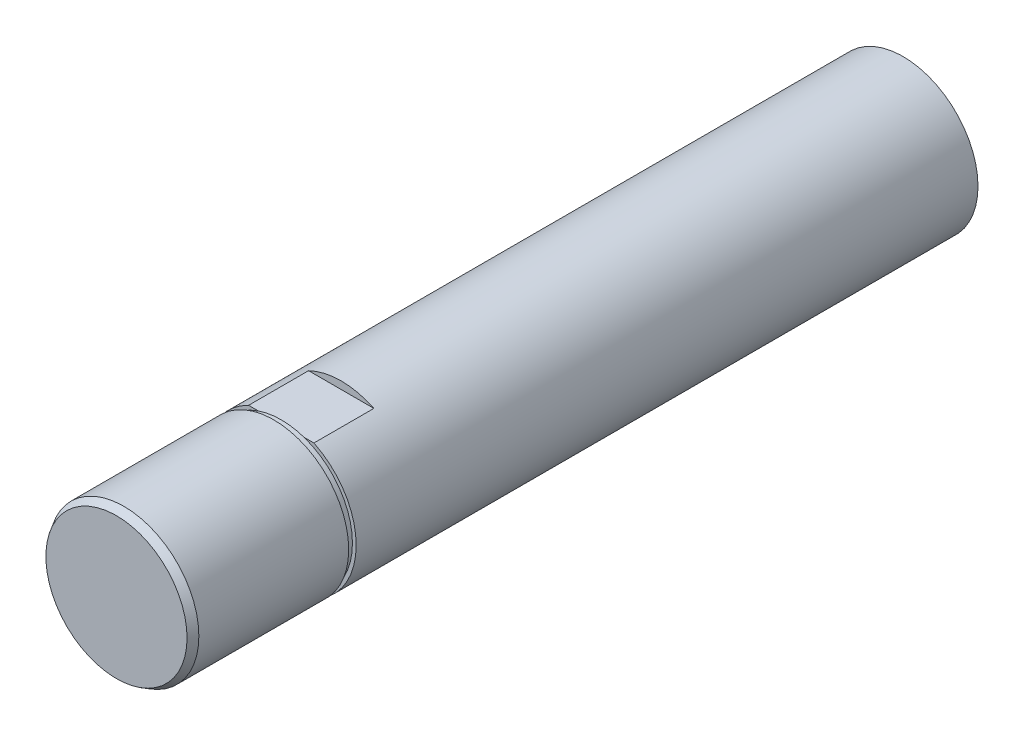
SolidWorks part; units mm, degrees
ref_plane "Front Plane" through (0, 0, 0) normal (0, 0, 1) x (1, 0, 0)
ref_plane "Top Plane" through (0, 0, 0) normal (0, 1, 0) x (1, 0, 0)
ref_plane "Right Plane" through (0, 0, 0) normal (1, 0, 0) x (0, 0, -1)
ref_plane "Plane1" through (0, 0, 8) normal (0, 0, 1) x (1, 0, 0)
sketch "Sketch1" plane through (0, 0, 0) normal (0, 0, 1) x (1, 0, 0)
  circle A0 centre (0, 0) radius 10
  dimension "D1" = 20
extrude "STROKE" add sketch "Sketch1" against normal blind 75
sketch "Sketch2" plane through (0, 0, 0) normal (0, 0, 1) x (1, 0, 0)
  circle A0 centre (0, 0) radius 10
  dimension "D1" = 20
extrude "L2" add sketch "Sketch2" along normal blind 11
sketch "Sketch3" plane through (0, 0, 8) normal (0, 0, 1) x (1, 0, 0)
  circle A0 centre (0, 0) radius 10
  dimension "D1" = 20
extrude "L3" add sketch "Sketch3" along normal blind 22
chamfer "Chamfer2" distance 1 angle 30 1 edges at (10, 0, 30)
sketch "Sketch5" plane through (0, 0, 8) normal (0, 0, 1) x (1, 0, 0)
  circle A0 centre (0, 0) radius 10
  circle A1 centre (0, 0) radius 9.5
  circle A4 centre (0, 0) radius 10 construction
  dimension "D1" = 20
  dimension "D2" = 19
extrude "U/C" cut sketch "Sketch5" along normal blind 1
sketch "Sketch6" plane through (0, 0, 0) normal (1, 0, 0) x (0, 0, -1)
  line L0 (-30, 9.4226) -> (-30, -9.4226) construction
  line L1 (-8, 10.5) -> (0, 10.5)
  line L2 (-8, -9) -> (-8, -10.5)
  line L3 (-8, 9) -> (0, 9)
  line L4 (0, 10.5) -> (0, 9)
  line L5 (-8, -9) -> (0, -9)
  line L6 (-8, 10.5) -> (-8, 9)
  line L7 (-8, -10.5) -> (0, -10.5)
  line L8 (0, -9) -> (0, -10.5)
  line L9 (75, -10) -> (75, 10) construction
  line L10 (75, 0) -> (-8, 0) construction
  line L12 (75, 0) -> (-8, 0) construction
  dimension "D1" = 8
  dimension "D2" = 18
  dimension "D3" = 9
  dimension "D4" = 22
  dimension "D5" = 21
  dimension "D6" = 20
  dimension "D7" = 10.5
extrude "A/F" cut sketch "Sketch6" against normal mid plane 21
equation "\"D2@Sketch5\" = \"D1@Sketch5\" - 1"
equation "\"D5@Sketch6\" = \"D2@Sketch6\"+3"
equation "\"D3@Sketch6\" = \"D2@Sketch6\" / 2"
equation "\"D2@Sketch6\" = \"D6@Sketch6\"-2"
equation "\"D7@Sketch6\" = \"D5@Sketch6\"/2"
